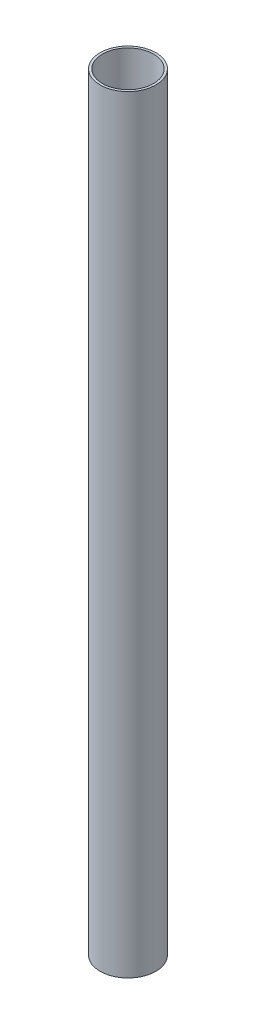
SolidWorks part; units mm, degrees
ref_plane "Front Plane" through (0, 0, 0) normal (0, 0, 1) x (1, 0, 0)
ref_plane "Top Plane" through (0, 0, 0) normal (0, 1, 0) x (1, 0, 0)
ref_plane "Right Plane" through (0, 0, 0) normal (1, 0, 0) x (0, 0, -1)
sketch "Sketch1" plane through (0, 0, 0) normal (0, 1, 0) x (1, 0, 0)
  circle A0 centre (0, 0) radius 12
  circle A1 centre (0, 0) radius 11
  dimension "D1" = 24
  dimension "D2" = 22
extrude "Boss-Extrude1" add sketch "Sketch1" against normal blind 330
